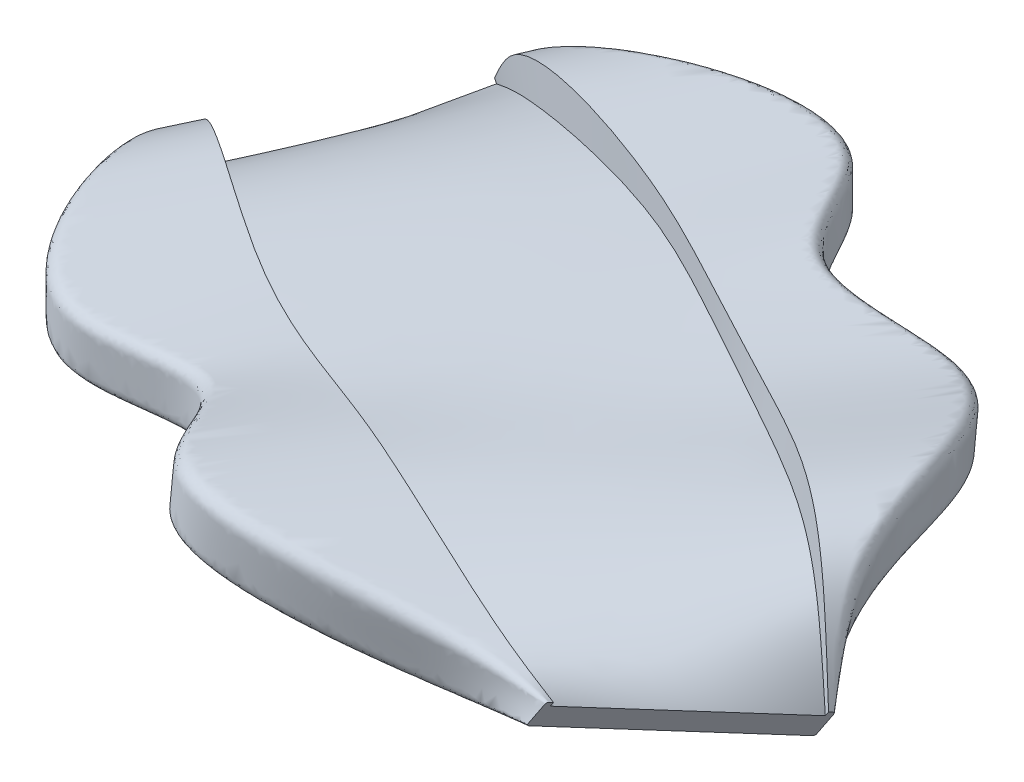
SolidWorks part; units mm, degrees
other "<Foam_Pad_&>-<Stock-Binding Start Sketch_&-1>"
ref_plane "Front Plane" through (0, 0, 0) normal (0, 0, 1) x (1, 0, 0)
ref_plane "Top Plane" through (0, 0, 0) normal (0, 1, 0) x (1, 0, 0)
ref_plane "Right Plane" through (0, 0, 0) normal (1, 0, 0) x (0, 0, -1)
mirrored part "Foam_Pad_&_Mirrored"
